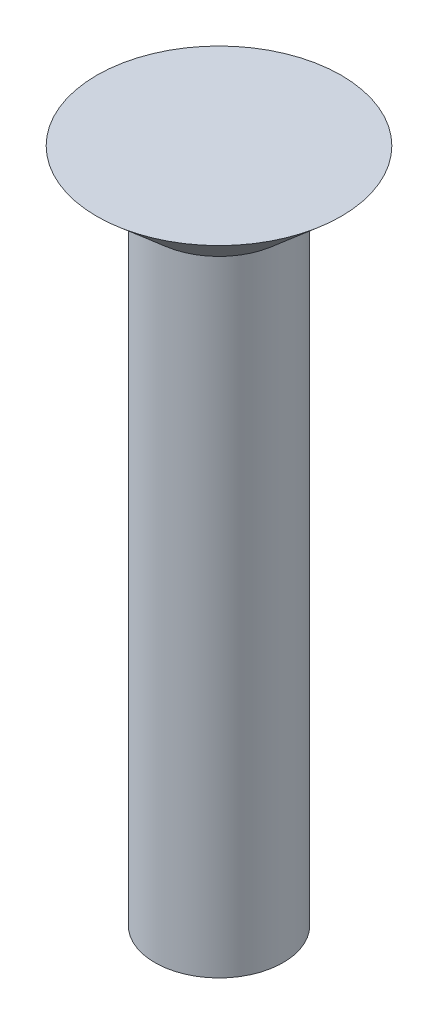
SolidWorks part; units mm, degrees
ref_plane "Front Plane" through (0, 0, 0) normal (0, 0, 1) x (1, 0, 0)
ref_plane "Top Plane" through (0, 0, 0) normal (0, 1, 0) x (1, 0, 0)
ref_plane "Right Plane" through (0, 0, 0) normal (1, 0, 0) x (0, 0, -1)
sketch "Sketch1" plane through (0, 0, 0) normal (0, 0, 1) x (1, 0, 0)
  line L0 (0, 0) -> (0, -25.4) construction
  line L1 (0, 0) -> (4.5974, 0)
  line L2 (4.5974, 0) -> (2.413, -1.8989)
  line L3 (2.413, -1.8989) -> (2.413, -25.4)
  line L4 (2.413, -25.4) -> (0, -25.4)
  line L5 (0, 0) -> (0, -25.4)
  dimension "D1" = 9.1948
  dimension "D2" = 4.826
  dimension "D3" = 41
  dimension "D4" = 25.4
revolve "Revolve1" add sketch "Sketch1" angle 360 about L0
